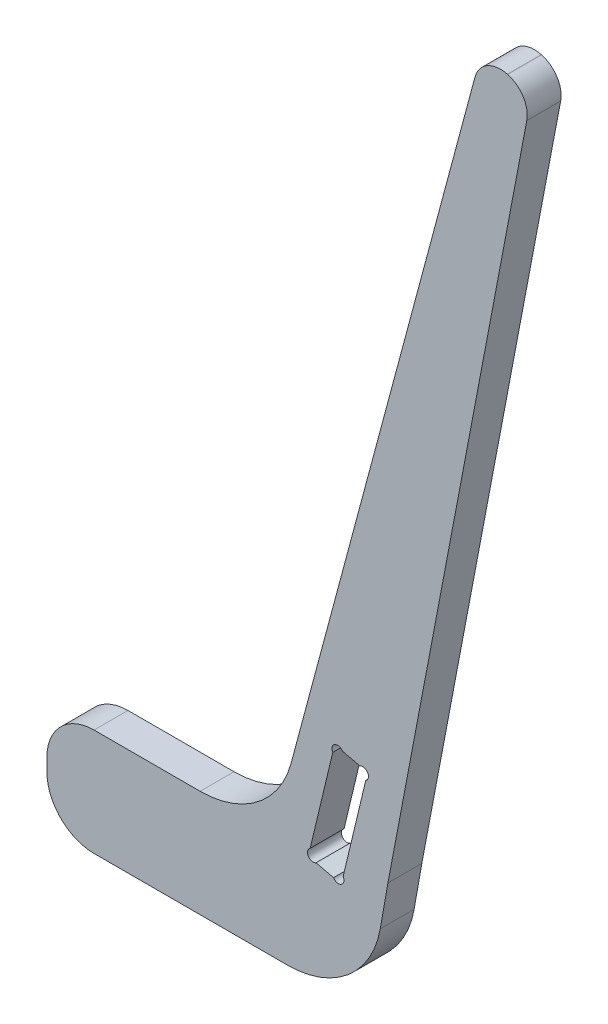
SolidWorks part; units mm, degrees
ref_plane "Plan de face" through (0, 0, 0) normal (0, 0, 1) x (1, 0, 0)
ref_plane "Plan de dessus" through (0, 0, 0) normal (0, 1, 0) x (1, 0, 0)
ref_plane "Plan de droite" through (0, 0, 0) normal (1, 0, 0) x (0, 0, -1)
sketch "Esquisse1" plane through (0, 0, 0) normal (0, 0, 1) x (1, 0, 0)
  line L9 (657.6105, 97.0071) -> (637.8385, 23.2171)
  line L18 (660.9349, 43.3989) -> (678.4399, 39.2066)
  line L25 (703.0011, 66.272) -> (703.0295, 66.4216)
  line L28 (637.8385, 23.2171) -> (657.6105, 97.0071)
  line L36 (703.0295, 66.4216) -> (703.0011, 66.272)
  line L37 (645.5854, 82.3807) -> (703.0295, 66.4216) construction
  line L38 (686.1906, 110.2117) -> (636.517, -97.2008) construction
  line L39 (660.9349, 43.3989) -> (662.9979, 42.9048)
  line L40 (646.9606, -14.9511) -> (664.4656, -19.1434)
  line L41 (660.9349, 43.3989) -> (646.9606, -14.9511)
  line L42 (678.4399, 39.2066) -> (664.4656, -19.1434)
  line L43 (662.5039, 40.8418) -> (660.4409, 41.3359) construction
  line L44 (660.4409, 41.3359) -> (662.5039, 40.8418) construction
  line L45 (662.5039, 40.8418) -> (662.9979, 42.9048) construction
  line L46 (665.0609, 42.4107) -> (678.4399, 39.2066)
  line L47 (662.9979, 42.9048) -> (665.0609, 42.4107)
  line L52 (508.2086, -70.5962) -> (635.9029, -70.5962)
  line L53 (652.9673, 79.6785) -> (703.0011, 66.272) construction
  line L54 (695.3779, 107.5929) -> (645.7043, -99.8196) construction
  line L55 (660.9349, 43.3989) -> (662.9979, 42.9048)
  line L56 (646.9606, -14.9511) -> (664.4656, -19.1434)
  line L57 (660.9349, 43.3989) -> (646.9606, -14.9511)
  line L58 (678.4399, 39.2066) -> (664.4656, -19.1434)
  line L59 (662.5039, 40.8418) -> (660.4409, 41.3359) construction
  line L60 (660.4409, 41.3359) -> (662.5039, 40.8418) construction
  line L61 (662.5039, 40.8418) -> (662.9979, 42.9048) construction
  line L62 (665.0609, 42.4107) -> (678.4399, 39.2066)
  line L63 (662.9979, 42.9048) -> (665.0609, 42.4107)
  line L67 (703.0011, 66.272) -> (703.0295, 66.4216)
  line L70 (637.8385, 23.2171) -> (739.0587, 400.9758)
  line L71 (685.1433, -29.2786) -> (689.2226, -6.1436)
  line L72 (657.6105, 97.0071) -> (637.8385, 23.2171)
  line L73 (508.2086, -13.842) -> (589.5422, -13.842)
  line L74 (637.8385, 23.2171) -> (657.6105, 97.0071)
  line L75 (702.037, 66.5303) -> (702.0651, 66.6896)
  line L77 (685.7186, 110.1811) -> (686.1552, 110.0641) construction
  line L78 (640.0884, 31.6139) -> (693.3632, 17.339) construction
  line L79 (685.7186, 110.1811) -> (636.045, -97.2315) construction
  line L80 (660.9349, 43.3989) -> (662.9979, 42.9048)
  line L81 (646.9606, -14.9511) -> (664.4656, -19.1434)
  line L82 (660.9349, 43.3989) -> (646.9606, -14.9511)
  line L83 (678.4399, 39.2066) -> (664.4656, -19.1434)
  line L84 (662.5039, 40.8418) -> (660.4409, 41.3359) construction
  line L85 (660.4409, 41.3359) -> (662.5039, 40.8418) construction
  line L86 (662.5039, 40.8418) -> (662.9979, 42.9048) construction
  line L87 (665.0609, 42.4107) -> (678.4399, 39.2066)
  line L88 (662.9979, 42.9048) -> (665.0609, 42.4107)
  line L90 (685.7186, 110.1811) -> (686.1552, 110.0641)
  line L94 (637.8385, 23.2171) -> (657.6105, 97.0071)
  line L99 (508.2086, -13.842) -> (508.2086, -70.5962)
  line L100 (660.9349, 43.3989) -> (678.4399, 39.2066)
  line L101 (694.1485, 19.7455) -> (716.0098, 134.6422)
  line L102 (637.8385, 23.2171) -> (657.6105, 97.0071)
  line L103 (716.0098, 134.6422) -> (689.2226, -6.1436)
  line L104 (645.5854, 82.3807) -> (703.0295, 66.4216) construction
  line L105 (686.1906, 110.2117) -> (636.517, -97.2008) construction
  line L106 (660.9349, 43.3989) -> (662.9979, 42.9048)
  line L107 (646.9606, -14.9511) -> (664.4656, -19.1434)
  line L108 (660.9349, 43.3989) -> (646.9606, -14.9511)
  line L109 (678.4399, 39.2066) -> (664.4656, -19.1434)
  line L110 (662.5039, 40.8418) -> (660.4409, 41.3359) construction
  line L111 (660.4409, 41.3359) -> (662.5039, 40.8418) construction
  line L112 (662.5039, 40.8418) -> (662.9979, 42.9048) construction
  line L113 (665.0609, 42.4107) -> (678.4399, 39.2066)
  line L114 (662.9979, 42.9048) -> (665.0609, 42.4107)
  line L115 (652.9673, 79.6785) -> (703.0011, 66.272) construction
  line L116 (695.3779, 107.5929) -> (645.7043, -99.8196) construction
  line L117 (660.9349, 43.3989) -> (662.9979, 42.9048)
  line L118 (646.9606, -14.9511) -> (664.4656, -19.1434)
  line L119 (660.9349, 43.3989) -> (646.9606, -14.9511)
  line L120 (678.4399, 39.2066) -> (664.4656, -19.1434)
  line L121 (662.5039, 40.8418) -> (660.4409, 41.3359) construction
  line L122 (660.4409, 41.3359) -> (662.5039, 40.8418) construction
  line L123 (662.5039, 40.8418) -> (662.9979, 42.9048) construction
  line L124 (665.0609, 42.4107) -> (678.4399, 39.2066)
  line L125 (662.9979, 42.9048) -> (665.0609, 42.4107)
  line L129 (689.2226, -6.1436) -> (765.3449, 393.9324)
  line L130 (739.0587, 400.9758) -> (765.3449, 393.9324)
  arc A11 (685.1433, -29.2786) -> (635.9029, -70.5962) centre (635.9029, -20.5962) cw
  arc A12 (637.8385, 23.2171) -> (589.5422, -13.842) centre (589.5422, 36.158) cw
  point P36 (669.6874, 41.3027)
  point P52 (678.8902, 38.7486)
  point P63 (669.231, 41.3368)
  point P71 (669.6874, 41.3027)
  point P92 (678.8902, 38.7486)
  point P104 (669.6874, 41.3027)
  dimension "D6" = 18
  dimension "D9" = 18
  dimension "D14" = 18
  dimension "D5" = 50
  dimension "D7" = 60
  dimension "D4" = 60
  dimension "D2" = 100
  dimension "D8" = 60
  dimension "D10" = 18
  dimension "D11" = 113.995
  dimension "D13" = 60
  dimension "D16" = 105
  dimension "D19" = 60
  dimension "D20" = 18
extrude "Boss.-Extru.1" add sketch "Esquisse1" along normal blind 18
fillet "Congé2" radius 25 2 edges at (508.2086, -70.5962, 9) (508.2086, -13.842, 9)
fillet "Congé3" radius 14 2 edges at (765.3449, 393.9324, 9) (739.0587, 400.9758, 9)
sketch "Esquisse4" plane through (0, 0, 18) normal (0, 0, 1) x (1, 0, 0)
  line L0 (662.5039, 40.8418) -> (662.9979, 42.9048) construction
  line L1 (660.9349, 43.3989) -> (678.4399, 39.2066) construction
  line L2 (662.5039, 40.8418) -> (660.4409, 41.3359) construction
  line L3 (660.9349, 43.3989) -> (646.9606, -14.9511) construction
  line L4 (669.6874, 41.3027) -> (655.7131, -17.0472) construction
  line L5 (646.9606, -14.9511) -> (664.4656, -19.1434) construction
  line L6 (653.9478, 14.2239) -> (671.4528, 10.0316) construction
  line L7 (678.4399, 39.2066) -> (664.4656, -19.1434) construction
  circle A0 centre (662.5039, 40.8418) radius 3
  circle A1 centre (662.8967, -16.5863) radius 3
  circle A2 centre (675.8829, 37.6377) radius 3
  circle A3 centre (649.5177, -13.3822) radius 3
  point P17 (662.7003, 12.1277)
  point P22 (662.7003, 12.1277)
  dimension "D1" = 6
  dimension "D2" = 2
extrude "Enlèv. mat.-Extru.2" cut sketch "Esquisse4" against normal through all
